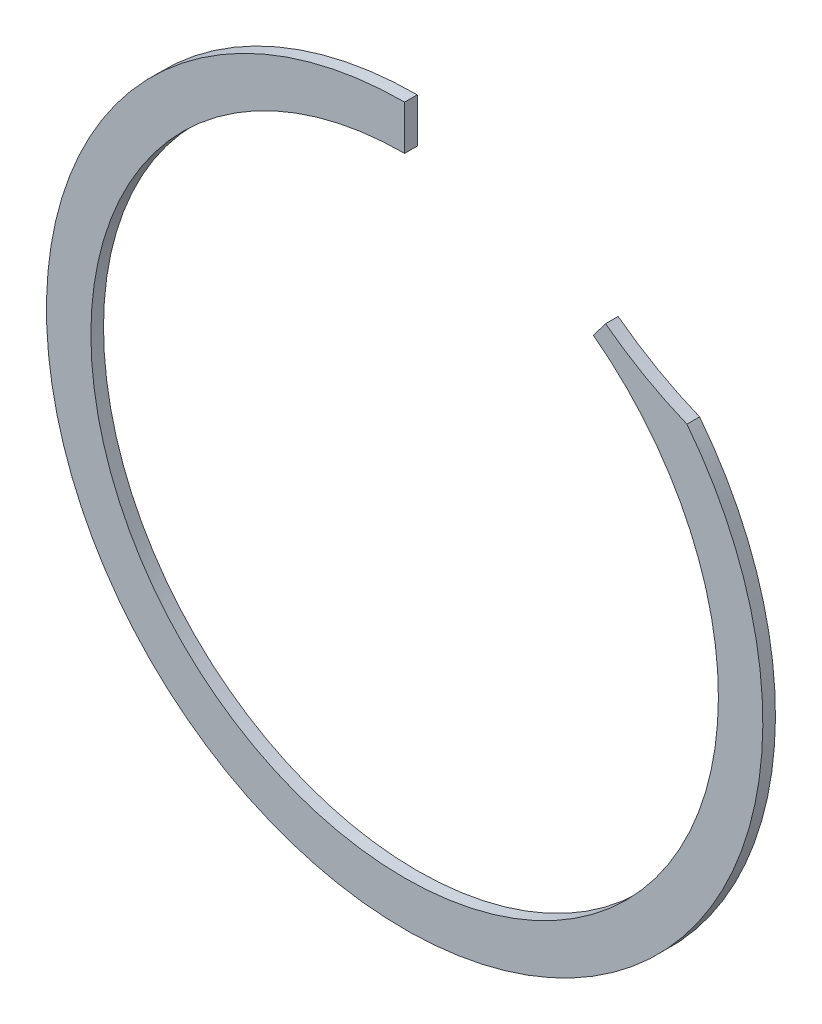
SolidWorks part; units mm, degrees
ref_plane "Front" through (0, 0, 0) normal (0, 0, 1) x (1, 0, 0)
ref_plane "Top" through (0, 0, 0) normal (0, 1, 0) x (1, 0, 0)
ref_plane "Right" through (0, 0, 0) normal (1, 0, 0) x (0, 0, -1)
sketch "Sketch1" plane through (0, 0, 0) normal (0, 0, 1) x (1, 0, 0)
  circle A0 centre (0, 0) radius 18.0213
  circle A1 centre (0, 0) radius 15.7861
  dimension "D1" = 36.0426
  dimension "D2" = 2.2352
extrude "Extrude1" add sketch "Sketch1" along normal blind 0.635
sketch "Sketch2" plane through (0, 0, 0) normal (0, 0, 1) x (1, 0, 0)
  line L0 (21.1326, 28.0533) -> (0, 0) construction
  line L1 (0, 0) -> (0, 18.0213)
  line L2 (0, 0) -> (10.108, 13.4182)
  line L3 (0, 18.0213) -> (5.8, 18.0213)
  arc A0 (10.108, 13.4182) -> (5.8, 18.0213) centre (21.1326, 28.0533) ccw
  circle A3 centre (0, 0) radius 18.0213 construction
extrude "Cut-Extrude1" cut sketch "Sketch2" along normal through all
